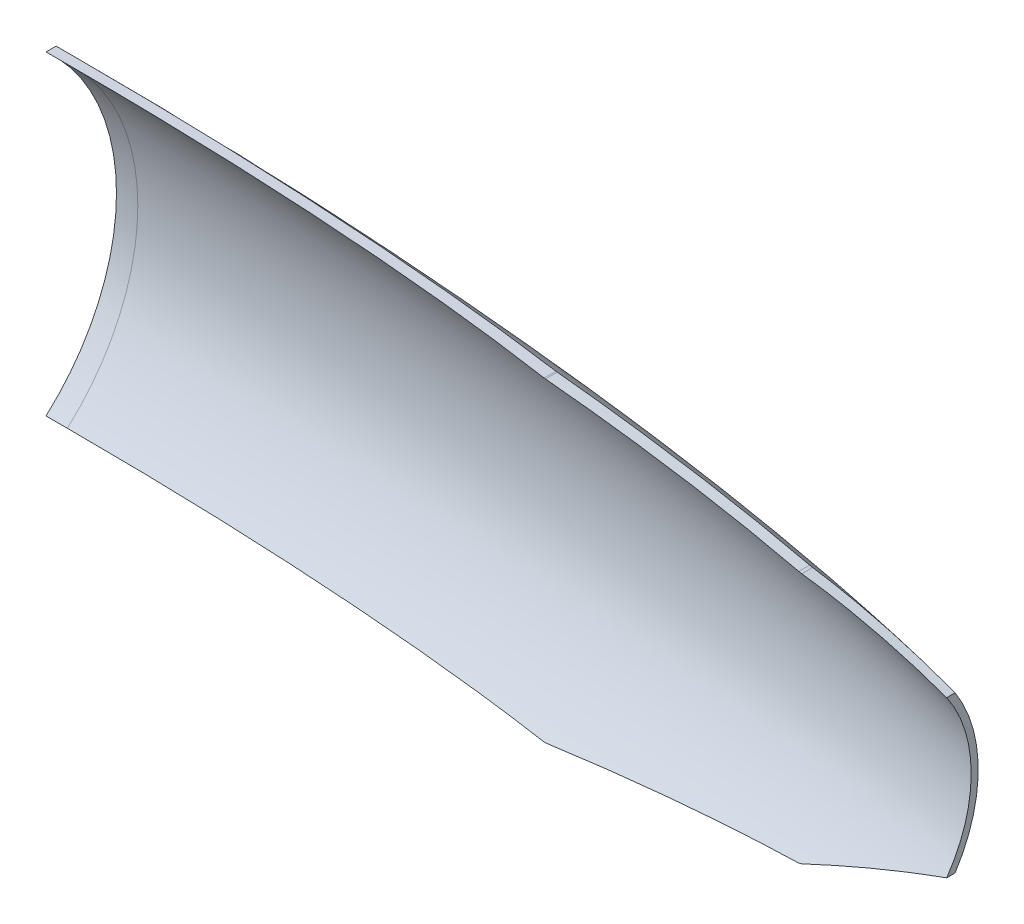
SolidWorks part; units mm, degrees
ref_plane "Plane1" through (0, 0, 0) normal (0, 0, 1) x (1, 0, 0)
ref_plane "Plane2" through (0, 0, 0) normal (0, 1, 0) x (1, 0, 0)
ref_plane "Plane3" through (0, 0, 0) normal (1, 0, 0) x (0, 0, -1)
sketch "Sketch1" plane through (0, 0, 0) normal (0, 0, 1) x (1, 0, 0)
  line L0 (0, 0) -> (558.8, 0) construction
  line L1 (558.8, 0) -> (0, 0)
  line L2 (0, 0) -> (0, 101.346)
  line L3 (0, 0) -> (558.8, 0) construction
  ellipse E0 centre (0, 0) end of major axis (558.8, 0) minor radius 101.346 (558.8, 0) -> (0, 101.346) ccw
  dimension "D1" = 558.8
  dimension "D2" = 101.346
revolve "Base-Revolve" add sketch "Sketch1" angle 180 about L0
sketch "Sketch19" plane through (0, 0, 0) normal (-1, 0, 0) x (0, 0, 1)
  circle A0 centre (0, 0) radius 101.346
extrude "Extrude1" add sketch "Sketch19" along normal blind 9.906
shell "Shell1" thickness 3.175
ref_plane "Plane5" through (0, 0, 101.6) normal (0, 0, 1) x (1, 0, 0)
sketch "Sketch2" plane through (0, 0, 0) normal (0, 0, 1) x (1, 0, 0)
  line L0 (415.29, 0) -> (0, 0) construction
  line L1 (0, 66.802) -> (236.728, 66.802)
  line L2 (236.728, 66.802) -> (294.64, 60.706)
  line L3 (294.64, 60.706) -> (358.14, 52.324)
  line L4 (358.14, 52.324) -> (415.29, 31.75)
  line L5 (415.29, 31.75) -> (415.29, -31.75)
  line L6 (0, -66.802) -> (0, 66.802)
  line L7 (358.14, -52.324) -> (415.29, -31.75)
  line L8 (294.64, -60.706) -> (358.14, -52.324)
  line L9 (236.728, -66.802) -> (294.64, -60.706)
  line L10 (0, -66.802) -> (236.728, -66.802)
  dimension "D1" = 236.728
  dimension "D2" = 57.912
  dimension "D3" = 63.5
  dimension "D4" = 57.15
  dimension "D5" = 66.802
  dimension "D6" = 60.706
  dimension "D7" = 52.324
  dimension "D8" = 31.75
  dimension "D9" = 415.29
sketch "Sketch18" plane through (0, 0, 101.6) normal (0, 0, 1) x (1, 0, 0)
  line L1 (0, 73.152) -> (-9.906, 73.152)
  line L2 (-9.906, 101.346) -> (-9.906, -101.346) construction
  line L3 (-9.906, 73.152) -> (-9.906, -73.152)
  line L4 (-9.906, -73.152) -> (0, -73.152)
  line L9 (421.64, 36.2129) -> (360.2909, 58.2986)
  line L11 (237.3927, 73.1171) -> (358.971, 58.6194)
  line L12 (421.64, -36.2129) -> (421.64, 36.2129)
  line L15 (358.971, 58.6194) -> (360.2909, 58.2986)
  line L17 (236.728, 73.152) -> (237.3927, 73.1171)
  line L18 (236.728, 73.152) -> (0, 73.152)
  line L22 (236.728, -73.152) -> (0, -73.152)
  line L23 (236.728, -73.152) -> (237.3927, -73.1171)
  line L25 (358.971, -58.6194) -> (360.2909, -58.2986)
  line L28 (237.3927, -73.1171) -> (358.971, -58.6194)
  line L30 (421.64, -36.2129) -> (360.2909, -58.2986)
  point P38 (421.64, 0)
  point P39 (415.29, 0)
extrude "Cut-Extrude15" cut sketch "Sketch18" against normal through all flip side to cut
